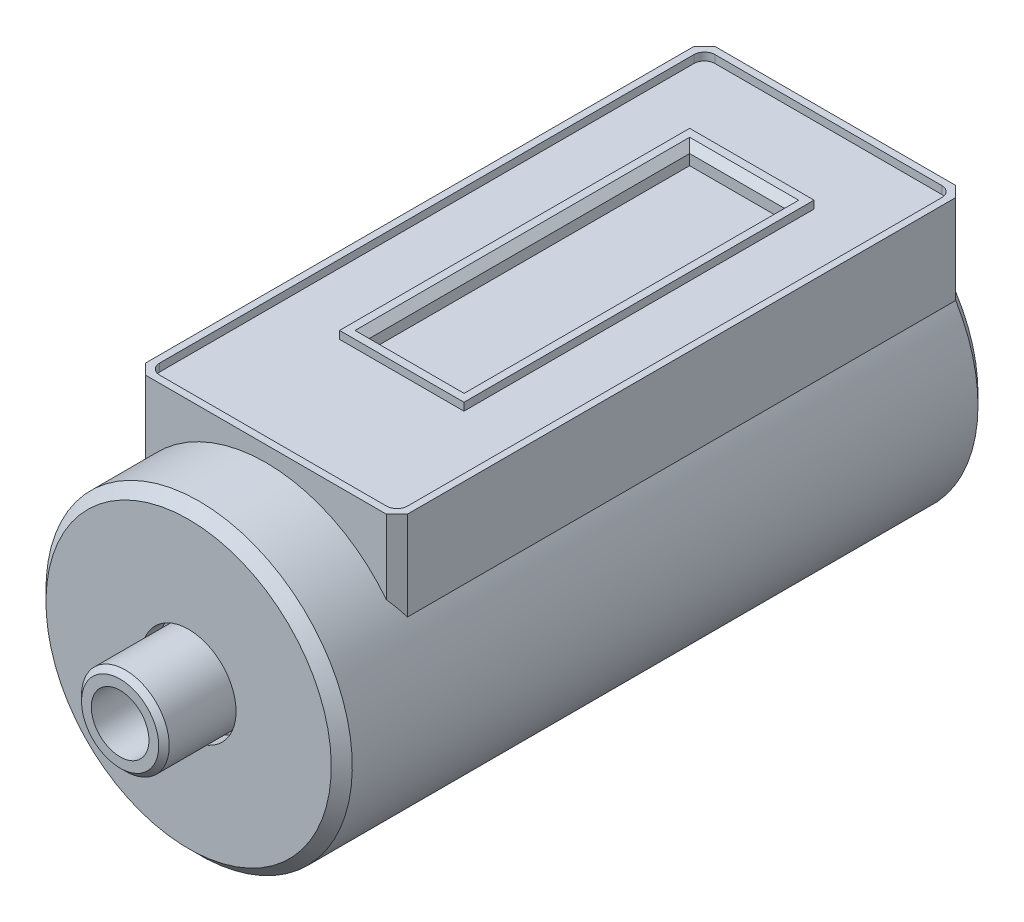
SolidWorks part; units mm, degrees
ref_plane "Front" through (0, 0, 0) normal (0, 0, 1) x (1, 0, 0)
ref_plane "Top" through (0, 0, 0) normal (0, 1, 0) x (1, 0, 0)
ref_plane "Right" through (0, 0, 0) normal (1, 0, 0) x (0, 0, -1)
sketch "Sketch2" plane through (0, 0, 0) normal (1, 0, 0) x (0, 0, -1)
  line L0 (144.31, 0) -> (144.31, 2.79)
  line L1 (144.69, 3.17) -> (150.53, 3.17)
  line L2 (149.26, 3.43) -> (149.26, 10.31)
  line L3 (150.02, 11.07) -> (196, 11.07)
  line L4 (196, 11.07) -> (196, 0)
  line L5 (196, 0) -> (144.31, 0)
  line L6 (149.26, 3.43) -> (150.53, 3.43)
  line L7 (150.53, 3.43) -> (150.53, 3.17)
  line L8 (144.31, 2.79) -> (144.69, 3.17)
  line L9 (149.26, 10.31) -> (150.02, 11.07)
  dimension "D1" = 51.69
  dimension "D2" = 3.17
  dimension "D3" = 11.07
  dimension "D4" = 4.95
  dimension "D5" = 1.27
  dimension "D6" = 3.43
  dimension "D7" = 2.79
  dimension "D8" = 0.38
  dimension "D9" = 0.76
  dimension "D10" = 10.31
  dimension "D11" = 196
revolve "Revolve1" add sketch "Sketch2" angle 360 about L5
sketch "Sketch3" plane through (0, 0, 0) normal (0, 1, 0) x (1, 0, 0)
  line L0 (11.07, 196) -> (-11.07, 196) construction
  line L1 (-9.46, 196) -> (9.46, 196)
  line L2 (-9.46, 196) -> (-9.46, 155.61)
  line L3 (-8.7, 154.85) -> (8.7, 154.85)
  line L4 (9.46, 196) -> (9.46, 155.61)
  line L5 (-9.46, 155.61) -> (-8.7, 154.85)
  line L6 (9.46, 155.61) -> (8.7, 154.85)
  point P1 (9.46, 154.85)
  point P2 (-9.46, 154.85)
  point P6 (0, 154.85)
  dimension "D1" = 41.15
  dimension "D2" = 18.92
extrude "Extrude1" add sketch "Sketch3" along normal blind 12.19
chamfer "Chamfer1" distance 0.76 angle 45 3 edges at (-9.46, 8.9696, -196) (0, -11.07, -196) (9.46, 8.9696, -196)
sketch "Sketch4" plane through (0, 12.19, 0) normal (0, 1, 0) x (1, 0, 0)
  line L0 (-8.7, 154.85) -> (8.7, 154.85) construction
  line L1 (-8.19, 195.49) -> (8.2, 195.49)
  line L2 (-8.95, 194.73) -> (-8.95, 156.12)
  line L3 (-8.19, 155.36) -> (8.2, 155.36)
  line L4 (8.96, 194.73) -> (8.96, 156.12)
  line L5 (-9.46, 155.61) -> (-9.46, 195.24) construction
  line L7 (-4.49, 189.96) -> (4.5, 189.96)
  line L8 (-4.49, 189.96) -> (-4.49, 164.66)
  line L9 (-4.49, 164.66) -> (4.5, 164.66)
  line L10 (4.5, 189.96) -> (4.5, 164.66)
  arc A0 (-8.95, 194.73) -> (-8.19, 195.49) centre (-8.19, 194.73) cw
  arc A1 (8.96, 194.73) -> (8.2, 195.49) centre (8.2, 194.73) ccw
  arc A2 (8.96, 156.12) -> (8.2, 155.36) centre (8.2, 156.12) cw
  arc A3 (-8.95, 156.12) -> (-8.19, 155.36) centre (-8.19, 156.12) ccw
  dimension "D5" = 0.76
  dimension "D1" = 17.91
  dimension "D2" = 40.13
  dimension "D3" = 0.51
  dimension "D4" = 0.51
  dimension "D6" = 5.53
  dimension "D7" = 4.46
  dimension "D8" = 4.46
  dimension "D9" = 25.3
extrude "Cut-Extrude1" cut sketch "Sketch4" against normal blind 0.56
sketch "Sketch5" plane through (0, 12.19, 0) normal (0, 1, 0) x (1, 0, 0)
  line L1 (-3.42, 188.89) -> (3.44, 188.89)
  line L2 (-3.42, 188.89) -> (-3.42, 165.73)
  line L3 (-3.42, 165.73) -> (3.44, 165.73)
  line L4 (3.44, 188.89) -> (3.44, 165.73)
  line L6 (4.5, 189.96) -> (-4.49, 189.96) construction
  line L7 (-4.49, 189.96) -> (-4.49, 164.66) construction
  point P4 (0.005, 189.96)
  dimension "D1" = 6.86
  dimension "D2" = 23.16
  dimension "D3" = 1.07
  dimension "D4" = 1.07
extrude "Cut-Extrude2" cut sketch "Sketch5" against normal blind 1.27
chamfer "Chamfer2" distance 0.51 angle 45 4 edges at (0.01, 12.19, -165.73) (3.44, 12.19, -177.31) (-3.42, 12.19, -177.31) (0.01, 12.19, -188.89)
hole_wizard "Hole1" positions "Sketch7" profile "Sketch6" legacy
sketch "Sketch7" plane through (0, 0, -144.31) normal (0, 0, 1) x (1, 0, 0)
  circle A0 centre (0, 0) radius 3.17 construction
  point P0 (0, 0)
sketch "Sketch6" plane through (0, 0, -144.31) normal (1, 0, 0) x (0, -1, 0)
  line L0 (0, 0) -> (0, 7.6015)
  line L1 (0, 7.6015) -> (2.0828, 6.35)
  line L2 (2.0828, 6.35) -> (2.0828, 0)
  line L4 (2.0828, 0) -> (0, 0)
  line L6 (0, 7.6015) -> (-2.0828, 6.35) construction
  line L7 (0, -4.2442) -> (0, 117.3081) construction
  dimension "Diameter" = 4.1656
  dimension "Depth" = 6.35
  dimension "Drill Angle" = 118
